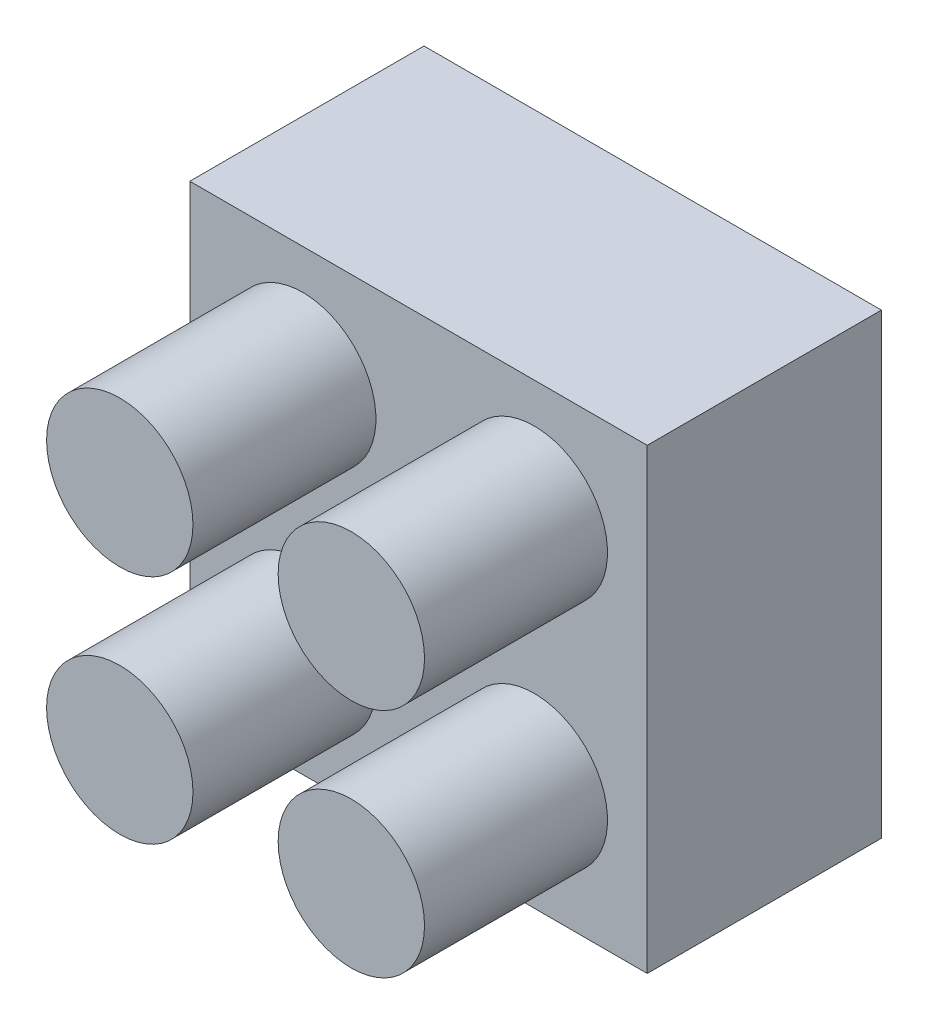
SolidWorks part; units mm, degrees
ref_plane "Front" through (0, 0, 0) normal (0, 0, 1) x (1, 0, 0)
ref_plane "Top" through (0, 0, 0) normal (0, 1, 0) x (1, 0, 0)
ref_plane "Right" through (0, 0, 0) normal (1, 0, 0) x (0, 0, -1)
sketch "Sketch1" plane through (0, 0, 0) normal (0, 0, 1) x (1, 0, 0)
  line L1 (-7.9375, -7.9375) -> (7.9375, -7.9375)
  line L2 (-7.9375, -7.9375) -> (-7.9375, 7.9375)
  line L3 (-7.9375, 7.9375) -> (7.9375, 7.9375)
  line L4 (7.9375, -7.9375) -> (7.9375, 7.9375)
  line L5 (-7.9375, -7.9375) -> (7.9375, 7.9375) construction
  line L6 (-7.9375, 7.9375) -> (7.9375, -7.9375) construction
  point P0 (0, 0)
  dimension "D1" = 15.875
  dimension "D2" = 15.875
extrude "Boss-Extrude1" add sketch "Sketch1" along normal blind 8.128
sketch "Sketch2" plane through (0, 0, 8.128) normal (0, 0, 1) x (1, 0, 0)
  line L1 (-4.0183, -4.0183) -> (4.0183, -4.0183)
  line L2 (-4.0183, -4.0183) -> (-4.0183, 4.0183)
  line L3 (-4.0183, 4.0183) -> (4.0183, 4.0183)
  line L4 (4.0183, -4.0183) -> (4.0183, 4.0183)
  line L5 (-4.0183, -4.0183) -> (4.0183, 4.0183) construction
  line L6 (-4.0183, 4.0183) -> (4.0183, -4.0183) construction
  circle A0 centre (-4.0183, 4.0183) radius 2.54
  circle A1 centre (4.0183, 4.0183) radius 2.54
  circle A2 centre (4.0183, -4.0183) radius 2.54
  circle A3 centre (-4.0183, -4.0183) radius 2.54
  point P0 (0, 0)
  dimension "D1" = 5.08
extrude "Boss-Extrude2" add sketch "Sketch2" along normal blind 6.35 contours L3 A0 L2 | L2 A0 L3 | L4 A1 L3 | L3 A1 L4 | L4 A2 L1 | L1 A2 L4 | L1 A3 L2 | L2 A3 L1
